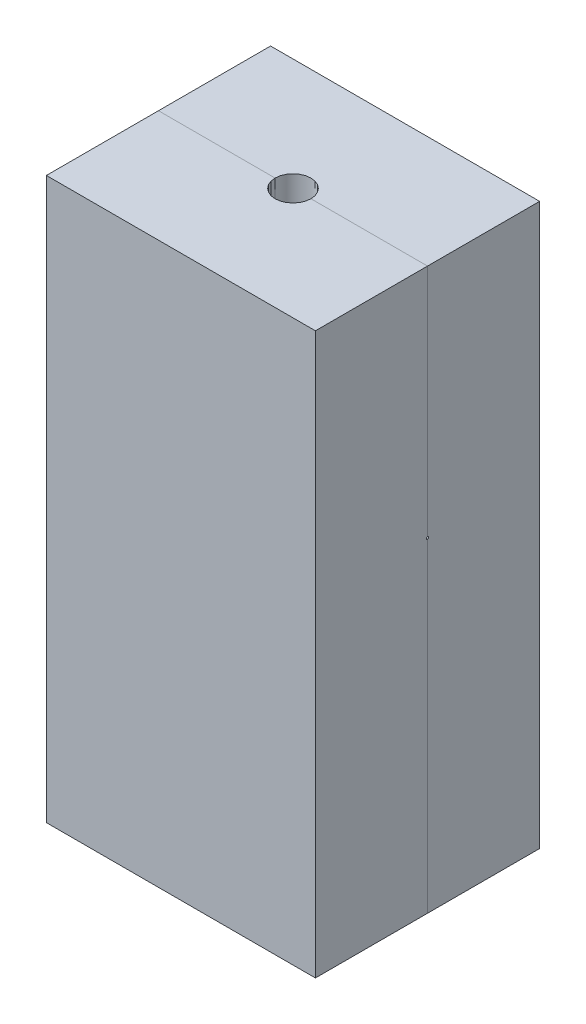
SolidWorks part; units mm, degrees
ref_plane "Front Plane" through (0, 0, 0) normal (0, 0, 1) x (1, 0, 0)
ref_plane "Top Plane" through (0, 0, 0) normal (0, 1, 0) x (1, 0, 0)
ref_plane "Right Plane" through (0, 0, 0) normal (1, 0, 0) x (0, 0, -1)
sketch "Sketch1" plane through (0, 0, 0) normal (1, 0, 0) x (0, 0, -1)
  line L0 (0, 0) -> (0, 70) construction
  line L1 (0, 70) -> (10, 70)
  line L2 (10, 70) -> (10, 63.5)
  line L3 (9.6508, 60) -> (13.0984, 60)
  line L4 (13.0984, 60) -> (13.0984, 58.5)
  line L5 (13.0984, 58.5) -> (9.5984, 58.5)
  line L6 (9.5984, 58.5) -> (7.8192, 7.5509)
  line L7 (10, 63.5) -> (11.2206, 62)
  line L8 (11.2206, 62) -> (9.7206, 62)
  line L9 (9.7206, 62) -> (9.6508, 60)
  line L10 (9.7206, 62) -> (9.6508, 60)
  line L11 (0, 0) -> (-9.6409, 0) construction
  arc A0 (7.8192, 7.5509) -> (0, 0) centre (0, 7.824) cw
  dimension "D1" = 70
  dimension "D2" = 10
  dimension "D3" = 2
  dimension "D4" = 1.5
  dimension "D5" = 3.5
  dimension "D6" = 10
  dimension "D7" = 2
  dimension "D8" = 1.5
  dimension "D9" = 1.5
  dimension "D11" = 90
  dimension "D12" = 9.7206
sketch "Sketch2" plane through (0, 0, 0) normal (1, 0, 0) x (0, 0, -1)
  line L0 (0, 0) -> (0, 70) construction
  line L1 (9.6508, 60) -> (13.0984, 60) construction
  line L2 (13.0984, 60) -> (13.0984, 58.5) construction
  line L3 (13.0984, 58.5) -> (9.5984, 58.5) construction
  line L4 (9.5984, 58.5) -> (7.8192, 7.5509) construction
  line L5 (9.7206, 62) -> (9.6508, 60) construction
  line L6 (0, 70) -> (10, 70) construction
  line L7 (10, 70) -> (10, 63.5) construction
  line L8 (10, 63.5) -> (11.2206, 62) construction
  line L9 (11.2206, 62) -> (9.7206, 62) construction
  line L10 (0, 0) -> (0, 70) construction
  line L11 (9.6508, 60) -> (13.0984, 60)
  line L12 (13.0984, 60) -> (13.0984, 58.5)
  line L13 (13.0984, 58.5) -> (9.5984, 58.5)
  line L14 (9.5984, 58.5) -> (7.8192, 7.5509)
  line L15 (9.7206, 62) -> (9.6508, 60)
  line L16 (0, 70) -> (10, 70) construction
  line L17 (10, 70) -> (10, 63.5)
  line L18 (10, 63.5) -> (11.2206, 62)
  line L19 (11.2206, 62) -> (9.7206, 62)
  line L20 (7, 70) -> (7, 60)
  line L21 (7, 70.0524) -> (6.9982, 70)
  line L22 (9.5984, 58.5) -> (0, 58.5) construction
  line L23 (6.5966, 58.5) -> (4.8211, 7.6556)
  line L24 (7, 60) -> (6.5966, 58.5)
  line L25 (10, 70) -> (6.9982, 70)
  line L26 (0, 3) -> (0, 0)
  arc A0 (0, 0) -> (7.8192, 7.5509) centre (0, 7.824) ccw construction
  arc A1 (0, 0) -> (7.8192, 7.5509) centre (0, 7.824) ccw
  arc A2 (4.8211, 7.6556) -> (0, 3) centre (0, 7.824) cw
  dimension "D1" = 3
  dimension "D2" = 3
  dimension "D3" = 3
  dimension "D4" = 1.5
sketch "Sketch3" plane through (0, 0, 0) normal (1, 0, 0) x (0, 0, -1)
  line L0 (0, 53) -> (0, -106)
  line L1 (0, -106) -> (-35.2901, -106) construction
  line L2 (25, -110) -> (35, -110)
  line L9 (0, 70) -> (10, 70) construction
  line L18 (10, 53) -> (0, 53)
  line L19 (35, -20) -> (35, -110)
  line L20 (35, -110) -> (0, -110) construction
  arc A0 (10, 53) -> (35, -20) centre (-84.08, -20) cw
  arc A1 (25, -110) -> (0, -106) centre (0, -186.125) ccw
  dimension "D4" = 17
  dimension "D5" = 10
  dimension "D6" = 4
  dimension "D1" = 180
  dimension "D2" = 35
  dimension "D3" = 90
  dimension "D7" = 25
revolve "Revolve2" add sketch "Sketch3" angle 360 about L0
fillet "Fillet1" radius 5 1 edges at (0, -110, 35)
sketch "Sketch4" plane through (0, 0, 0) normal (1, 0, 0) x (0, 0, -1)
  line L0 (0, 0) -> (0, -118.2469) construction
  line L1 (35, -105) -> (35, -20) construction
  arc A0 (35, -20) -> (35, -90) centre (149.7824, -55) ccw
  dimension "D1" = 20
  dimension "D3" = 120
  dimension "D2" = 70
extrude "Cut-Extrude1" cut sketch "Sketch4" against normal through all both and the other way through all
mirror "Mirror1" about plane through (0, 0, 0) normal (0, 0, 1) of "Cut-Extrude1"
fillet "Fillet2" radius 5 2 edges at (1.7218, -89.8607, -34.9576) (-2.0781, -89.7969, 34.9383)
shell "Shell1" thickness 0.5
sketch "Sketch5" plane through (0, 0, 0) normal (1, 0, 0) x (0, 0, -1)
  line L0 (13.0984, 60) -> (13.0984, 58.5) construction
  line L1 (9.6508, 60) -> (13.0984, 60) construction
  line L2 (13.0984, 58.5) -> (9.5984, 58.5) construction
  line L3 (9.7206, 62) -> (9.6508, 60) construction
  line L4 (11.2206, 62) -> (9.7206, 62) construction
  line L5 (10, 63.5) -> (11.2206, 62) construction
  line L6 (10, 70) -> (10, 63.5) construction
  line L8 (13.0984, 60) -> (13.0984, 58.5)
  line L9 (9.6508, 60) -> (13.0984, 60)
  line L10 (13.0984, 58.5) -> (9.5984, 58.5)
  line L11 (9.7206, 62) -> (9.6508, 60)
  line L12 (11.2206, 62) -> (9.7206, 62)
  line L13 (10, 63.5) -> (11.2206, 62)
  line L14 (10, 70) -> (10, 63.5)
  line L15 (10, 70) -> (8.5, 70)
  line L16 (8.5, 70) -> (8.5, 58.5)
  line L18 (9.5984, 58.5) -> (34.9976, -19.2383)
  line L20 (9.5984, 58.5) -> (0, 58.5) construction
  line L21 (10, 53) -> (-10, 53) construction
  line L22 (9.3663, 53) -> (-9.3663, 53) construction
  line L23 (0, 70.1912) -> (0, 58.5) construction
  line L24 (9.3609, 53) -> (34.9976, -19.2383)
  arc A0 (9.3609, 53) -> (8.5, 58.5) centre (26.5, 58.5) cw
  dimension "D2" = 18
  dimension "D1" = 1.5
revolve "Revolve3" add sketch "Sketch5" angle 360 about L23
sketch "Sketch6" plane through (0, 0, 0) normal (0, 0, 1) x (1, 0, 0)
  line L1 (-60, 125) -> (60, 125)
  line L2 (-60, 125) -> (-60, -125)
  line L3 (-60, -125) -> (60, -125)
  line L4 (60, 125) -> (60, -125)
  line L5 (-60, 125) -> (60, -125) construction
  line L6 (-60, -125) -> (60, 125) construction
  point P0 (0, 0)
  dimension "D1" = 120
  dimension "D2" = 250
sketch "Sketch7" plane through (0, 70, 0) normal (0, 1, 0) x (1, 0, 0)
  circle A1 centre (0, 0) radius 10
  circle A2 centre (0, 0) radius 10
  dimension "D1" = 0
extrude "Boss-Extrude1" add sketch "Sketch7" against normal blind 2
extrude "Boss-Extrude2" add sketch "Sketch6" along normal mid plane 100 separate body
combine bodies "Combine1" operation type subtract main body 107 bodies to subtract 106
split "Split1" trim tools "Front Plane" bodies to split 108 resulting bodies 110 111
sketch "Sketch8" plane through (0, 125, 0) normal (0, 1, 0) x (1, 0, 0)
  line L0 (60, 0) -> (-60, 0) construction
  circle A0 centre (0, 0) radius 8
  dimension "D1" = 16
extrude "Cut-Extrude2" cut sketch "Sketch8" against normal blind 100
sketch "Sketch9" plane through (0, 0, 0) normal (0, 0, 1) x (1, 0, 0)
  line L0 (-25, -103) -> (-25, -133)
  line L1 (-25, -133) -> (-25.5, -133)
  line L2 (-25.5, -133) -> (-25.5, -103)
  line L3 (-25, -103) -> (-25.5, -103)
  line L4 (0, 0) -> (0, -125) construction
  line L5 (-60, -125) -> (60, -125) construction
  dimension "D1" = 0.5
  dimension "D2" = 30
  dimension "D3" = 25
  dimension "D4" = 8
revolve "Cut-Revolve1" cut sketch "Sketch9" angle 360 about L0
sketch "Sketch13" plane through (0, 0, 0) normal (0, 0, 1) x (1, 0, 0)
  line L0 (20, 20) -> (70, 20)
  line L1 (70, 20) -> (70, 20.5)
  line L2 (70, 20.5) -> (20, 20.5)
  line L3 (20, 20.5) -> (20, 20)
  line L4 (0, 0) -> (0, 37.9651) construction
  dimension "D1" = 0.5
  dimension "D2" = 20
  dimension "D3" = 50
  dimension "D4" = 20
revolve "Cut-Revolve2" cut sketch "Sketch13" angle 360 about L0
mirror "Mirror2" about plane through (0, 0, 0) normal (1, 0, 0) of "Cut-Revolve2", "Cut-Revolve1"
